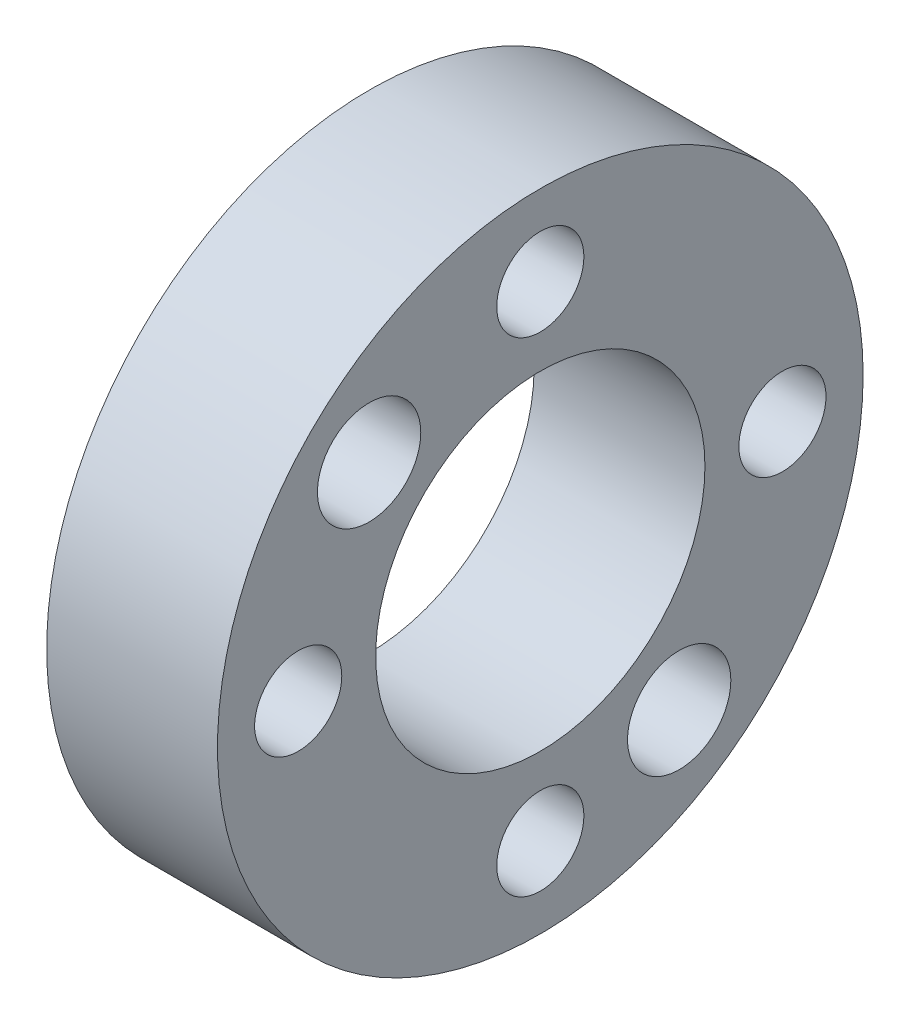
SolidWorks part; units mm, degrees
ref_plane "Vorne" through (0, 0, 0) normal (0, 0, 1) x (1, 0, 0)
ref_plane "Oben" through (0, 0, 0) normal (0, 1, 0) x (1, 0, 0)
ref_plane "Rechts" through (0, 0, 0) normal (1, 0, 0) x (0, 0, -1)
sketch "Skizze1" plane through (0, 0, 0) normal (0, 0, 1) x (1, 0, 0)
  line L0 (0, 0) -> (-12.5413, 0) construction
  line L1 (0, 5.1) -> (5.291, 5.1)
  line L2 (0, 5.1) -> (0, 10)
  line L3 (0, 10) -> (5.291, 10)
  line L4 (5.291, 5.1) -> (5.291, 10)
  dimension "D1" = 5.1
  dimension "D2" = 10
  dimension "D3" = 5.291
revolve "Rotation1" add sketch "Skizze1" angle 360 about L0
hole_wizard "Ø2.7 (2.7) Durchmesser Bohrung1" positions "Skizze3" profile "Skizze2" hole size "Ø2.7" standard "ISO"
sketch "Skizze3" plane through (5.291, 0, 0) normal (1, 0, 0) x (0, 0, -1)
  point P0 (0, 7.5)
  dimension "D1" = 7.5
sketch "Skizze2" plane through (5.291, 7.5, 0) normal (0, 1, 0) x (0, 0, -1)
  line L0 (0, 0) -> (0, 5.291)
  line L1 (0, 5.291) -> (1.35, 5.291)
  line L2 (1.35, 5.291) -> (1.35, 0)
  line L5 (1.35, 0) -> (0, 0)
  line L11 (0, -6.35) -> (0, 107.95) construction
  dimension "Bohrerdurchmesser" = 2.7
  dimension "Bohrungstiefe" = 5.291
pattern_circular "Kreismuster1" count 4 over 360 about axis through (0, 0, 0) along (1, 0, 0) of "Ø2.7 (2.7) Durchmesser Bohrung1"
sketch "Skizze4" plane through (5.291, 0, 0) normal (1, 0, 0) x (0, 0, -1)
  line L0 (-5.3033, 5.3033) -> (0, 0) construction
  line L1 (0, 0) -> (4.3018, -6.1436) construction
  line L2 (0, 0) -> (0, -7.5) construction
  line L3 (0, 0) -> (-7.5, 0) construction
  circle A0 centre (-5.3033, 5.3033) radius 1.6
  circle A1 centre (4.3018, -6.1436) radius 1.6
  dimension "D5" = 3.2
  dimension "D6" = 3.2
  dimension "D1" = 45
  dimension "D2" = 7.5
  dimension "D3" = 7.5
  dimension "D4" = 35
extrude "Schnitt-Linear austragen1" cut sketch "Skizze4" against normal through all
